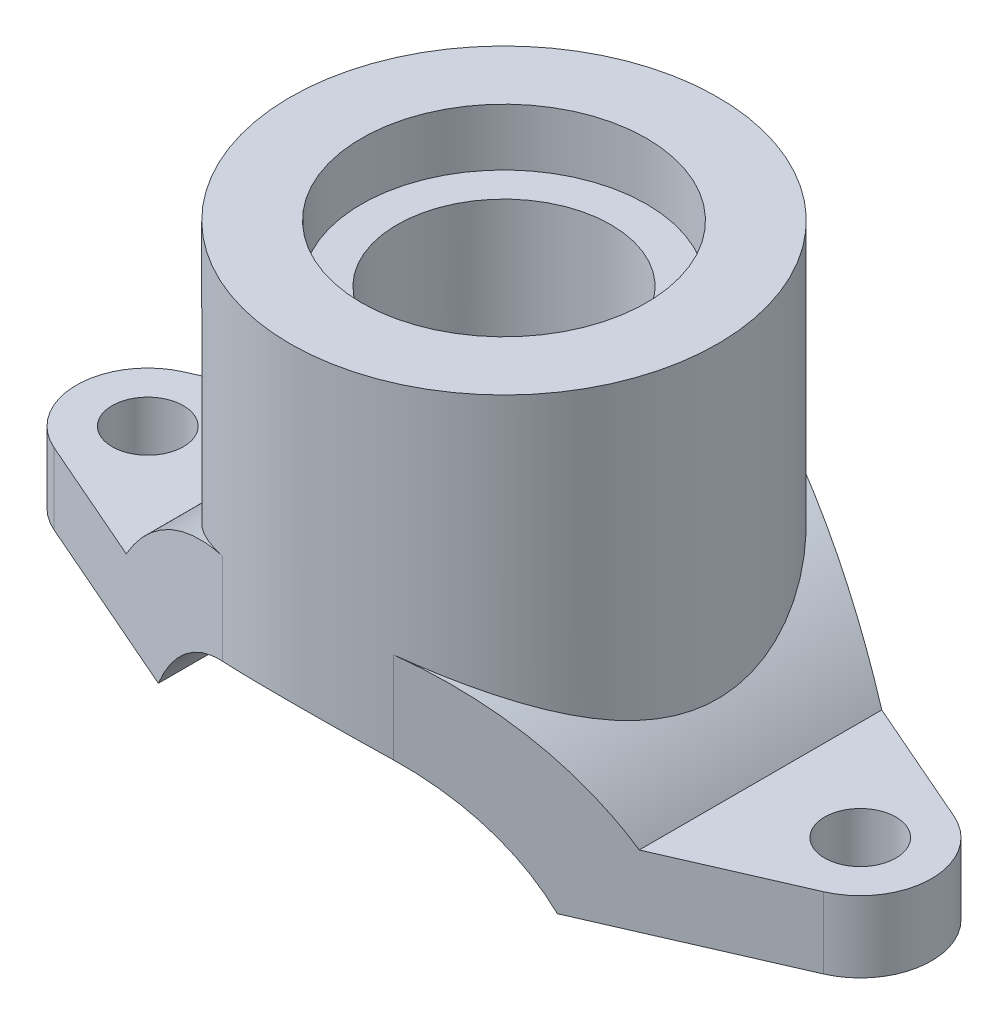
SolidWorks part; units mm, degrees
ref_plane "Front" through (0, 0, 0) normal (0, 0, 1) x (1, 0, 0)
ref_plane "Top" through (0, 0, 0) normal (0, 1, 0) x (1, 0, 0)
ref_plane "Right" through (0, 0, 0) normal (1, 0, 0) x (0, 0, -1)
sketch "Sketch1" plane through (0, 0, 0) normal (0, 0, 1) x (1, 0, 0)
  line L0 (0, 0) -> (0, 133.4612) construction
  line L1 (-150, 25) -> (-90, 25)
  line L2 (-150, 25) -> (-150, 0)
  line L3 (-150, 0) -> (-70, 0)
  line L4 (150, 25) -> (150, 0)
  line L5 (70, 0) -> (150, 0)
  line L6 (90, 25) -> (150, 25)
  line L7 (-150, 0) -> (150, 0) construction
  arc A0 (-70, 0) -> (70, 0) centre (0, -38.7298) cw
  arc A1 (-90, 25) -> (90, 25) centre (0, -38.7298) cw
  dimension "D2" = 80
  dimension "D5" = 60
  dimension "D1" = 300
  dimension "D3" = 80
  dimension "D4" = 25
extrude "Extrude1" add sketch "Sketch1" along normal mid plane 150
sketch "Sketch2" plane through (0, 0, 0) normal (0, 1, 0) x (1, 0, 0)
  line L0 (0, 105.087) -> (0, -105.087) construction
  line L4 (135, 22.9129) -> (30, 68.7386)
  line L5 (-135, 22.9129) -> (-30, 68.7386)
  line L11 (135, -22.9129) -> (30, -68.7386)
  line L12 (-135, -22.9129) -> (-30, -68.7386)
  arc A0 (-30, -68.7386) -> (30, -68.7386) centre (0, 0) ccw
  arc A1 (135, -22.9129) -> (135, 22.9129) centre (125, 0) ccw
  arc A2 (-135, -22.9129) -> (-135, 22.9129) centre (-125, 0) cw
  arc A3 (30, 68.7386) -> (-30, 68.7386) centre (0, 0) ccw
  dimension "D2" = 250
  dimension "D3" = 25
  dimension "D1" = 75
extrude "Cut-Extrude1" cut sketch "Sketch2" along normal through all flip side to cut
ref_plane "Plane1" through (0, 150, 0) normal (0, 1, 0) x (-1, 0, 0)
sketch "Sketch3" plane through (0, 150, 0) normal (0, 1, 0) x (-1, 0, 0)
  circle A0 centre (0, 0) radius 75
  arc A2 (30, 68.7386) -> (-30, 68.7386) centre (0, 0) ccw construction
extrude "Extrude2" add sketch "Sketch3" against normal up to surface (78.4507 mm away)
sketch "Sketch4" plane through (0, 0, 0) normal (0, 0, 1) x (1, 0, 0)
  line L0 (0, 0) -> (0, 176.9076) construction
  line L1 (75, 150) -> (-75, 150) construction
  line L2 (0, 150) -> (50, 150)
  line L3 (105.3063, 150) -> (-105.3063, 150) construction
  line L4 (50, 150) -> (50, 130)
  line L5 (50, 130) -> (37.5, 130)
  line L6 (37.5, 130) -> (37.5, 25)
  line L7 (37.5, 25) -> (0, 25)
  line L8 (0, 25) -> (0, 150)
  dimension "D1" = 100
  dimension "D2" = 75
  dimension "D3" = 20
  dimension "D4" = 125
revolve "Cut-Revolve1" cut sketch "Sketch4" angle 360 about L0
sketch "Sketch6" plane through (0, 25, 0) normal (0, 1, 0) x (-1, 0, 0)
  line L0 (0, -101.5631) -> (0, 127.636) construction
  line L1 (0, 106.7484) -> (0, 11.5032) construction
  circle A0 centre (125, 0) radius 12.5
  circle A1 centre (-125, 0) radius 12.5
  arc A2 (135, -22.9129) -> (135, 22.9129) centre (125, 0) ccw construction
  dimension "D1" = 25
extrude "Cut-Extrude2" cut sketch "Sketch6" against normal through all
